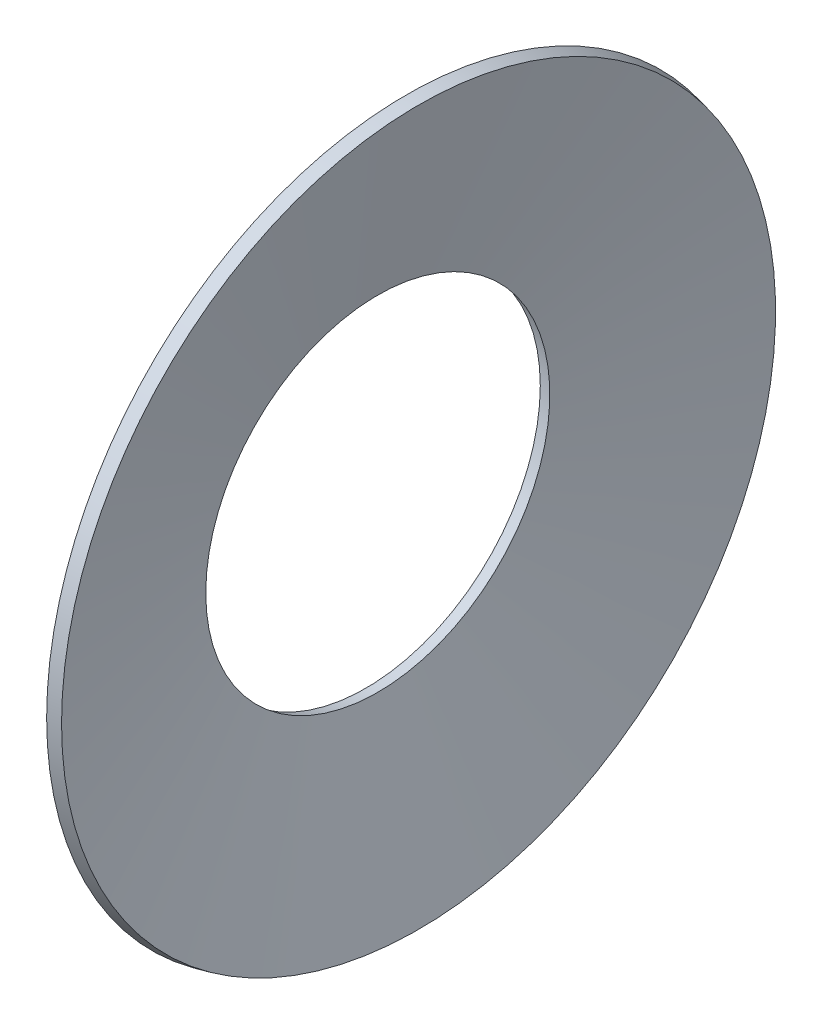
SolidWorks part; units mm, degrees
ref_plane "FACE" through (0, 0, 0) normal (0, 0, 1) x (1, 0, 0)
ref_plane "DESSUS" through (0, 0, 0) normal (0, 1, 0) x (1, 0, 0)
ref_plane "GAUCHE" through (0, 0, 0) normal (1, 0, 0) x (0, 0, -1)
sketch "Esquisse1" plane through (0, 0, 0) normal (0, 0, 1) x (1, 0, 0)
  line L0 (0, 0) -> (10, 0) construction
  line L1 (0, 5.5861) -> (1.3034, 11.5)
  line L2 (1.3034, 11.5) -> (1.694, 11.4139)
  line L3 (1.694, 11.4139) -> (0.3906, 5.5)
  line L4 (0.3906, 5.5) -> (0, 5.5861)
  line L5 (0, 0) -> (0, 15) construction
  dimension "D1" = 5.5
  dimension "D2" = 11.5
  dimension "D3" = 0.4
  dimension "D5" = 1.694
revolve "Base-Révolution" add sketch "Esquisse1" angle 360 about L0
